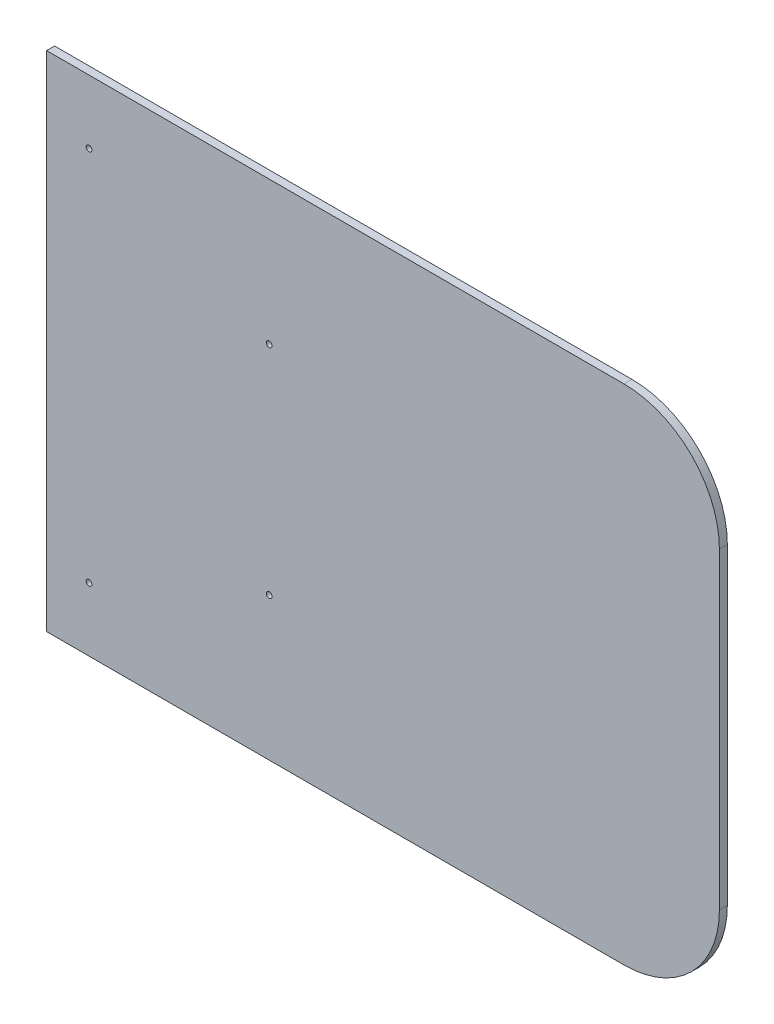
SolidWorks part; units mm, degrees
ref_plane "Front Plane" through (0, 0, 0) normal (0, 0, 1) x (1, 0, 0)
ref_plane "Top Plane" through (0, 0, 0) normal (0, 1, 0) x (1, 0, 0)
ref_plane "Right Plane" through (0, 0, 0) normal (1, 0, 0) x (0, 0, -1)
sketch "Sketch1" plane through (0, 0, 0) normal (0, 0, 1) x (1, 0, 0)
  line L1 (-403.225, -301.625) -> (403.225, -301.625)
  line L2 (-403.225, -301.625) -> (-403.225, 301.625)
  line L3 (-403.225, 301.625) -> (403.225, 301.625)
  line L4 (403.225, -301.625) -> (403.225, 301.625)
  line L5 (-403.225, -301.625) -> (403.225, 301.625) construction
  line L6 (-403.225, 301.625) -> (403.225, -301.625) construction
  point P0 (0, 0)
  dimension "D1" = 806.45
  dimension "D2" = 603.25
extrude "Extrude1" add sketch "Sketch1" along normal mid plane 9.525
sketch "Sketch2" plane through (0, 0, 4.7625) normal (0, 0, 1) x (1, 0, 0)
  line L0 (-352.425, 212.8736) -> (-352.425, -200.6684) construction
  line L1 (-136.525, 206.412) -> (-136.525, -188.4631) construction
  line L2 (-403.225, 301.625) -> (-403.225, -301.625) construction
  line L3 (403.225, 301.625) -> (-403.225, 301.625) construction
  circle A0 centre (-352.425, 225.425) radius 3.429
  circle A1 centre (-352.425, -225.425) radius 3.429
  circle A2 centre (-136.525, -130.175) radius 3.429
  circle A3 centre (-136.525, 130.175) radius 3.429
  dimension "D3" = 6.858
  dimension "D4" = 76.2
  dimension "D5" = 171.45
  dimension "D6" = 527.05
  dimension "D1" = 50.8
  dimension "D2" = 266.7
  dimension "D7" = 431.8
extrude "Extrude2" cut sketch "Sketch2" against normal through all
fillet "Fillet1" radius 114.3 2 edges at (403.225, 301.625, 0) (403.225, -301.625, 0)
